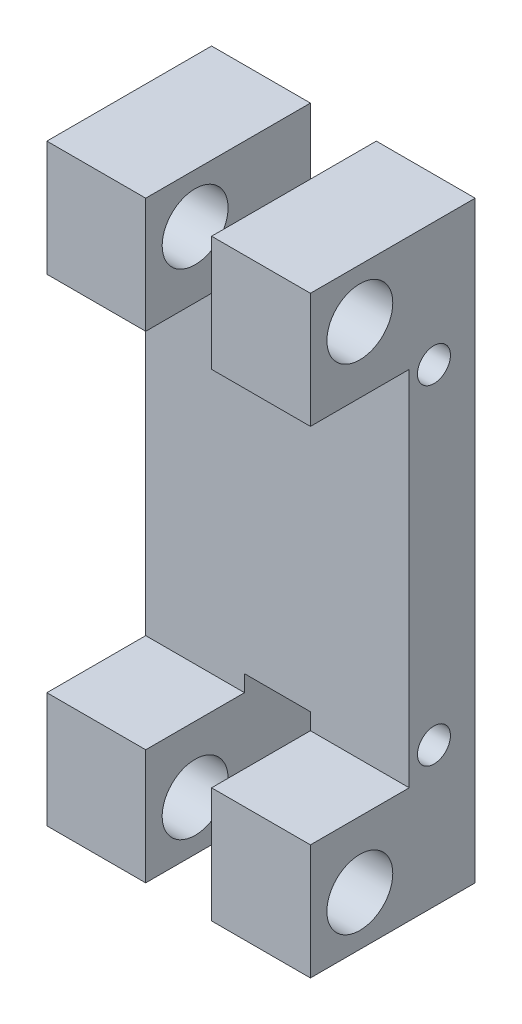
SolidWorks part; units mm, degrees
ref_plane "Front Plane" through (0, 0, 0) normal (0, 0, 1) x (1, 0, 0)
ref_plane "Top Plane" through (0, 0, 0) normal (0, 1, 0) x (1, 0, 0)
ref_plane "Right Plane" through (0, 0, 0) normal (1, 0, 0) x (0, 0, -1)
sketch "Sketch1" plane through (0, 0, 0) normal (0, 0, 1) x (1, 0, 0)
  line L1 (-25.4, -57.15) -> (25.4, -57.15)
  line L2 (-25.4, -57.15) -> (-25.4, 57.15)
  line L3 (-25.4, 57.15) -> (25.4, 57.15)
  line L4 (25.4, -57.15) -> (25.4, 57.15)
  line L5 (-25.4, -57.15) -> (25.4, 57.15) construction
  line L6 (-25.4, 57.15) -> (25.4, -57.15) construction
  point P0 (0, 0)
  dimension "D1" = 50.8
  dimension "D2" = 114.3
extrude "Boss-Extrude1" add sketch "Sketch1" along normal mid plane 31.75
sketch "Sketch2" plane through (25.4, 0, 0) normal (1, 0, 0) x (0, 0, -1)
  line L0 (-15.875, -57.15) -> (-15.875, 57.15) construction
  line L1 (-15.875, 57.15) -> (15.875, 57.15) construction
  line L2 (-15.875, -57.15) -> (15.875, -57.15) construction
  line L3 (-40.7572, 0) -> (41.1383, 0) construction
  line L5 (-34.925, -34.925) -> (3.175, -34.925)
  line L6 (-34.925, -34.925) -> (-34.925, 34.925)
  line L7 (-34.925, 34.925) -> (3.175, 34.925)
  line L8 (3.175, -34.925) -> (3.175, 34.925)
  line L9 (-34.925, -34.925) -> (3.175, 34.925) construction
  line L10 (-34.925, 34.925) -> (3.175, -34.925) construction
  circle A0 centre (-6.35, 47.625) radius 6.35
  circle A1 centre (-6.35, -47.625) radius 6.35
  point P14 (-15.875, 0)
  dimension "D3" = 12.7
  dimension "D1" = 9.525
  dimension "D2" = 9.525
  dimension "D4" = 9.525
  dimension "D5" = 69.85
  dimension "D6" = 38.1
extrude "Cut-Extrude1" cut sketch "Sketch2" against normal through all
sketch "Sketch3" plane through (0, 0, -15.875) normal (0, 0, -1) x (-1, 0, 0)
  line L0 (0, 49.1513) -> (0, -45.7685) construction
  line L1 (-25.4, 57.15) -> (25.4, 57.15) construction
  line L2 (-6.35, 31.75) -> (6.35, 31.75)
  line L3 (-6.35, 31.75) -> (-6.35, 69.85)
  line L4 (-6.35, 69.85) -> (6.35, 69.85)
  line L5 (6.35, 31.75) -> (6.35, 69.85)
  line L6 (-6.35, 31.75) -> (6.35, 69.85) construction
  line L7 (-6.35, 69.85) -> (6.35, 31.75) construction
  line L8 (-6.35, -31.75) -> (6.35, -31.75)
  line L9 (-6.35, -31.75) -> (-6.35, -69.85)
  line L10 (-6.35, -69.85) -> (6.35, -69.85)
  line L11 (6.35, -31.75) -> (6.35, -69.85)
  line L12 (-6.35, -31.75) -> (6.35, -69.85) construction
  line L13 (-6.35, -69.85) -> (6.35, -31.75) construction
  line L14 (25.4, -57.15) -> (-25.4, -57.15) construction
  point P3 (0, 50.8)
  point P8 (0, -50.8)
  point P17 (0, 0)
  dimension "D1" = 6.35
  dimension "D2" = 6.35
  dimension "D3" = 12.7
  dimension "D4" = 38.1
extrude "Cut-Extrude2" cut sketch "Sketch3" against normal through all
sketch "Sketch9" plane through (25.4, 0, 0) normal (1, 0, 0) x (0, 0, -1)
  circle A0 centre (7.9375, 33.3375) radius 3.175 construction
  circle A1 centre (7.9375, 33.3375) radius 3.175
  circle A2 centre (7.9375, -30.1625) radius 3.175 construction
  circle A3 centre (7.9375, -30.1625) radius 3.175
extrude "Cut-Extrude5" cut sketch "Sketch9" against normal blind 12.7
sketch "Sketch10" plane through (-25.4, 0, 0) normal (-1, 0, 0) x (0, 0, 1)
  circle A0 centre (-7.9375, 36.5125) radius 3.175 construction
  circle A1 centre (-7.9375, -26.9875) radius 3.175 construction
  circle A2 centre (-7.9375, 36.5125) radius 3.175
  circle A3 centre (-7.9375, -26.9875) radius 3.175
extrude "Cut-Extrude6" cut sketch "Sketch10" against normal blind 12.7
